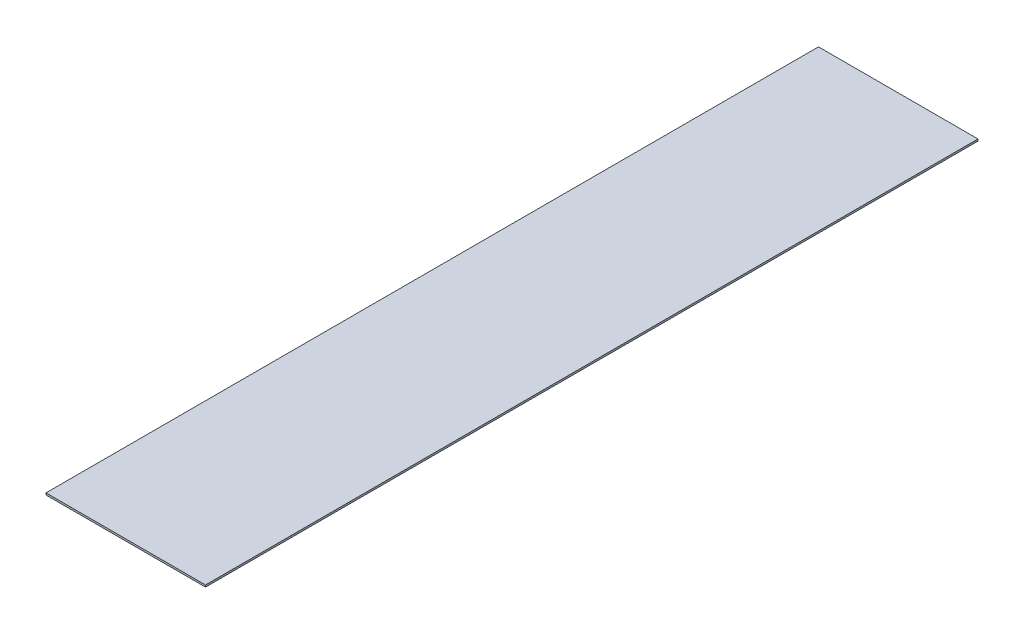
SolidWorks part; units mm, degrees
ref_plane "Front Plane" through (0, 0, 0) normal (0, 0, 1) x (1, 0, 0)
ref_plane "Top Plane" through (0, 0, 0) normal (0, 1, 0) x (1, 0, 0)
ref_plane "Right Plane" through (0, 0, 0) normal (1, 0, 0) x (0, 0, -1)
sketch "Sketch1" plane through (0, 0, 0) normal (0, 1, 0) x (1, 0, 0)
  line L1 (-267.4937, 1295.4) -> (267.4938, 1295.4)
  line L2 (-267.4937, 1295.4) -> (-267.4937, -1295.4)
  line L3 (-267.4937, -1295.4) -> (267.4938, -1295.4)
  line L4 (267.4938, 1295.4) -> (267.4938, -1295.4)
  line L5 (-267.4937, 1295.4) -> (267.4938, -1295.4) construction
  line L6 (-267.4937, -1295.4) -> (267.4938, 1295.4) construction
  point P0 (0, 0)
  dimension "D1" = 534.9875
  dimension "D2" = 2590.8
sheet metal parameters "Sheet-Metal1" thickness 6.35 parameters "D1"=4.7625
base flange "Base-Flange1" sketch "Sketch1" thickness 6.35 reverse thickness direction no parameters "D1"=4.7625
flat pattern "Flat-Pattern1"
sketch "Bend-Lines1" plane through (0, 0, 0) normal (0, 1, 0) x (-1, 0, 0)
